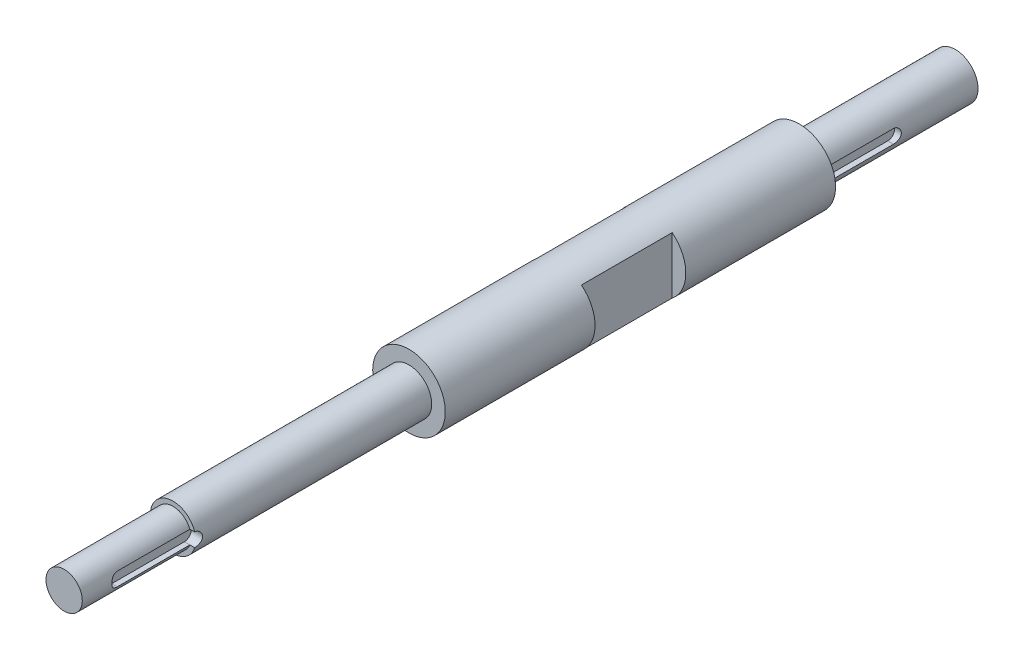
SolidWorks part; units mm, degrees
ref_plane "Front Plane" through (0, 0, 0) normal (0, 0, 1) x (1, 0, 0)
ref_plane "Top Plane" through (0, 0, 0) normal (0, 1, 0) x (1, 0, 0)
ref_plane "Right Plane" through (0, 0, 0) normal (1, 0, 0) x (0, 0, -1)
sketch "Sketch3" plane through (0, 0, 0) normal (0, 0, 1) x (1, 0, 0)
  circle A0 centre (0, 0) radius 6.35
  dimension "D1" = 12.7
extrude "Boss-Extrude1" add sketch "Sketch3" along normal blind 38.1
sketch "Sketch5" plane through (0, 0, 0) normal (0, 0, -1) x (-1, 0, 0)
  circle A0 centre (0, 0) radius 7.9375
  dimension "D1" = 15.875
extrude "Boss-Extrude2" add sketch "Sketch5" along normal blind 82.55
sketch "Sketch6" plane through (0, 0, -82.55) normal (0, 0, -1) x (-1, 0, 0)
  circle A0 centre (0, 0) radius 12.7
  dimension "D1" = 25.4
extrude "Boss-Extrude3" add sketch "Sketch6" along normal blind 136.525
ref_plane "Plane2" through (6.35, 0, 0) normal (1, 0, 0) x (0, 0, -1)
sketch "Sketch8" plane through (6.35, 0, 0) normal (1, 0, 0) x (0, 0, -1)
  line L0 (-25.4, 0) -> (0, 0) construction
  line L1 (-25.4, 2.3813) -> (0, 2.3813)
  line L2 (-25.4, -2.3813) -> (0, -2.3813)
  line L3 (0, 7.9375) -> (0, -7.9375) construction
  arc A0 (-25.4, 2.3813) -> (-25.4, -2.3813) centre (-25.4, 0) ccw
  arc A1 (0, -2.3813) -> (0, 2.3813) centre (0, 0) ccw
  point P3 (-12.7, 0)
  dimension "D1" = 0
  dimension "D2" = 25.4
  dimension "D3" = 4.7625
extrude "Cut-Extrude2" cut sketch "Sketch8" against normal blind 2.3813 and the other way through all
sketch "Sketch9" plane through (0, 0, -219.075) normal (0, 0, -1) x (-1, 0, 0)
  circle A0 centre (0, 0) radius 7.9375
  dimension "D1" = 15.875
extrude "Boss-Extrude4" add sketch "Sketch9" along normal blind 54.61
ref_plane "Plane3" through (7.9375, 0, 0) normal (1, 0, 0) x (0, 0, -1)
sketch "Sketch10" plane through (7.9375, 0, 0) normal (1, 0, 0) x (0, 0, -1)
  line L0 (219.075, 0) -> (244.475, 0) construction
  line L1 (219.075, -7.9375) -> (219.075, 7.9375) construction
  line L2 (219.075, 2.3813) -> (244.475, 2.3813)
  line L3 (219.075, -2.3813) -> (244.475, -2.3813)
  arc A0 (219.075, 2.3813) -> (219.075, -2.3813) centre (219.075, 0) ccw
  arc A1 (244.475, -2.3813) -> (244.475, 2.3813) centre (244.475, 0) ccw
  point P5 (231.775, 0)
  dimension "D1" = 25.4
  dimension "D2" = 4.7625
extrude "Cut-Extrude3" cut sketch "Sketch10" against normal blind 2.3813
sketch "Sketch15" plane through (0, 0, 0) normal (0, 1, 0) x (1, 0, 0)
  line L0 (-12.7, 219.075) -> (-12.7, 82.55) construction
  line L1 (-12.7, 166.6875) -> (-7.9375, 166.6875)
  line L2 (-12.7, 166.6875) -> (-12.7, 134.9375)
  line L3 (-12.7, 134.9375) -> (-7.9375, 134.9375)
  line L4 (-7.9375, 166.6875) -> (-7.9375, 134.9375)
  line L5 (12.7, 82.55) -> (12.7, 219.075) construction
  line L6 (12.7, 166.6875) -> (7.9375, 166.6875)
  line L7 (12.7, 166.6875) -> (12.7, 134.9375)
  line L8 (12.7, 134.9375) -> (7.9375, 134.9375)
  line L9 (7.9375, 166.6875) -> (7.9375, 134.9375)
  line L10 (-12.7, 82.55) -> (12.7, 82.55) construction
  line L11 (-12.7, 134.9375) -> (19.1459, 134.9375) construction
  dimension "D1" = 52.3875
  dimension "D2" = 15.875
  dimension "D3" = 4.7625
  dimension "D4" = 31.75
  dimension "D5" = 31.75
extrude "Cut-Extrude5" cut sketch "Sketch15" against normal through all both and the other way through all
